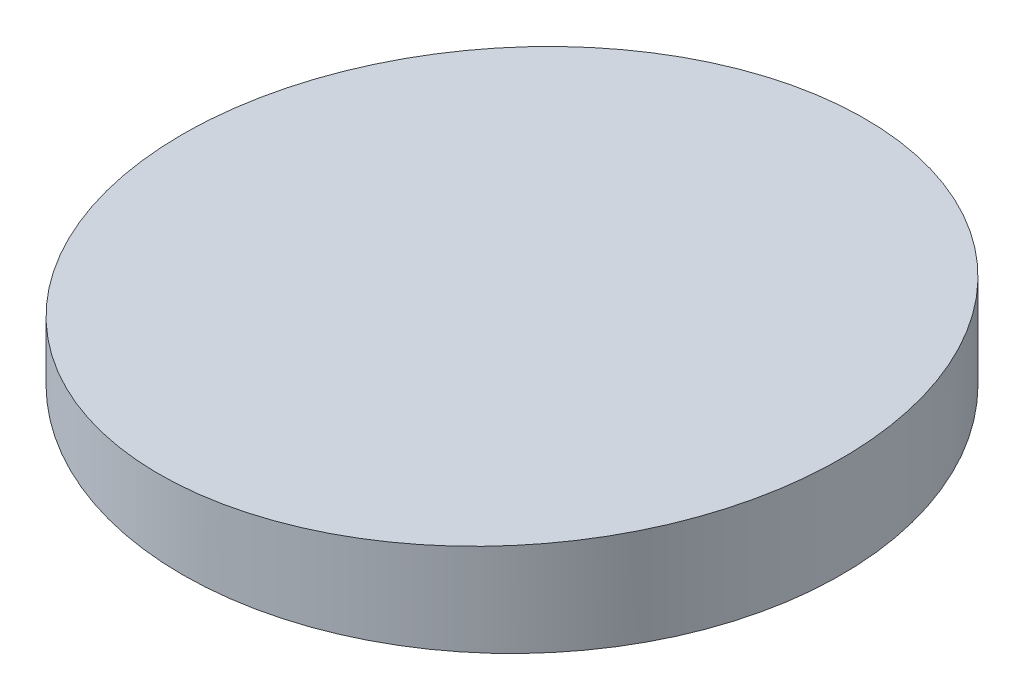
SolidWorks part; units mm, degrees
ref_plane "Front Plane" through (0, 0, 0) normal (0, 0, 1) x (1, 0, 0)
ref_plane "Top Plane" through (0, 0, 0) normal (0, 1, 0) x (1, 0, 0)
ref_plane "Right Plane" through (0, 0, 0) normal (1, 0, 0) x (0, 0, -1)
sketch "Sketch1" plane through (0, 0, 0) normal (0, 1, 0) x (1, 0, 0)
  circle A0 centre (0, 0) radius 50.8
  dimension "D1" = 101.6
extrude "Extrude1" add sketch "Sketch1" along normal blind 15.5194
sketch "Sketch2" plane through (0, 0, 0) normal (0, 0, 1) x (1, 0, 0)
  line L0 (50.8, 15.5194) -> (-50.8, 8.0049)
  line L1 (-50.8, 15.5194) -> (-50.8, 0) construction
  line L2 (-50.8, 0) -> (50.8, 0) construction
  dimension "D1" = 4.23
extrude "Extrude2" cut sketch "Sketch2" along normal through all and the other way through all flip side to cut
ref_plane "Plane1" through (0, 0, 0) normal (0, 0, 1) x (1, 0, 0)
sketch "Sketch3" [suppressed] plane through (-0.8652, 11.6981, 0) normal (-0.0738, 0.9973, 0) x (0.9973, 0.0738, 0)
  line L0 (-50.0712, 0) -> (51.8063, 0) construction
  line L1 (-27.7925, 0) -> (27.7925, 0) construction
  ellipse E0 centre (0.8676, 0) end of major axis (-50.0712, 0) minor radius 50.8 construction
